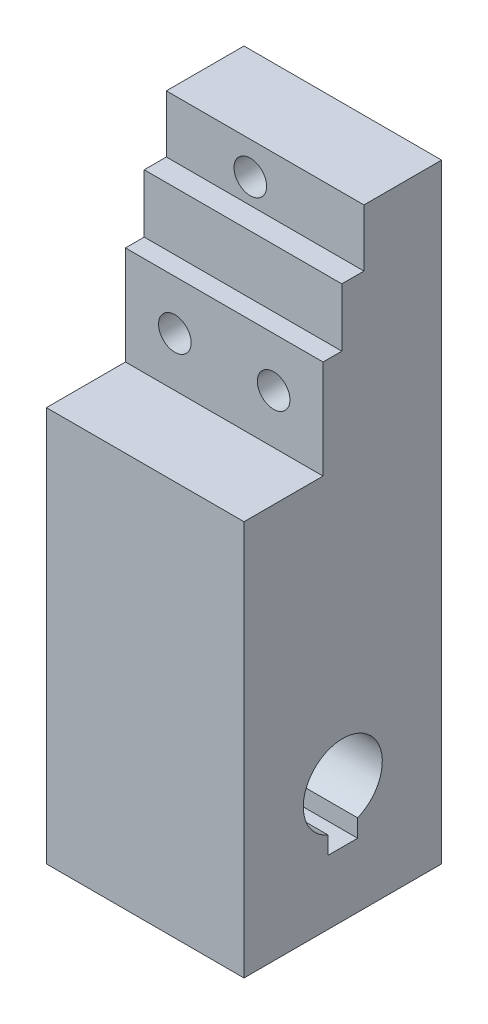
SolidWorks part; units mm, degrees
ref_plane "前视基准面" through (0, 0, 0) normal (0, 0, 1) x (1, 0, 0)
ref_plane "上视基准面" through (0, 0, 0) normal (0, 1, 0) x (1, 0, 0)
ref_plane "右视基准面" through (0, 0, 0) normal (1, 0, 0) x (0, 0, -1)
sketch "草图1" plane through (0, 0, 0) normal (0, 0, 1) x (1, 0, 0)
  line L0 (0, 61.7) -> (20, 61.7)
  line L1 (0, 0) -> (20, 0)
  line L2 (0, 0) -> (0, 61.7)
  line L3 (20, 0) -> (20, 61.7)
extrude "凸台-拉伸1" add sketch "草图1" along normal blind 20
sketch "草图2" plane through (20, 0, 0) normal (1, 0, 0) x (0, 0, -1)
  line L0 (-10.1, 50) -> (-10.1, 55.9)
  line L1 (-10.1, 55.9) -> (-7.86, 55.9)
  line L2 (-7.86, 55.9) -> (-7.86, 61.7)
  line L3 (0, 0) -> (0, 61.7)
  line L4 (-12, 50) -> (-10.1, 50)
  line L5 (-12, 40) -> (-12, 50)
  line L6 (-20, 0) -> (0, 0)
  line L7 (-7.86, 61.7) -> (0, 61.7)
  line L8 (-20, 0) -> (-20, 40)
  line L9 (-20, 40) -> (-12, 40)
extrude "切除-拉伸1" cut sketch "草图2" against normal blind 20 flip side to cut
sketch "草图8" plane through (20, 0, 0) normal (1, 0, 0) x (0, 0, -1)
  line L0 (-8.5, 6.5) -> (-8.5, 8.2919)
  line L1 (-11.5, 6.5) -> (-11.5, 8.2919)
  line L2 (-11.5, 6.5) -> (-8.5, 6.5)
  arc A0 (-8.5, 8.2919) -> (-11.5, 8.2919) centre (-10, 12) ccw
extrude "切除-拉伸3" cut sketch "草图8" against normal blind 20
sketch "草图9" plane through (0, 0, 20) normal (0, 0, 1) x (1, 0, 0)
  circle A0 centre (10, 12) radius 1.65
sketch "草图10" plane through (0, 0, 0) normal (0, 0, -1) x (-1, 0, 0)
  circle A0 centre (-10, 12) radius 1.65
extrude "切除-拉伸4" cut sketch "草图10" against normal blind 8
sketch "草图12" plane through (0, 0, 12) normal (0, 0, 1) x (1, 0, 0)
  circle A0 centre (5, 45) radius 1.65
  circle A1 centre (15, 45) radius 1.65
  circle A2 centre (8.5, 58.4) radius 1.65
extrude "切除-拉伸5" cut sketch "草图12" against normal through all
